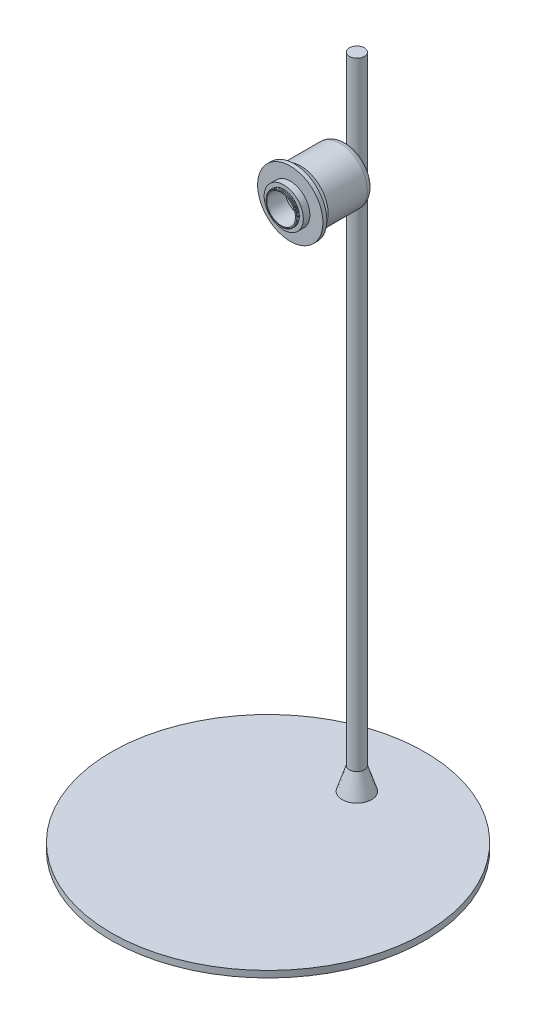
SolidWorks part; units mm, degrees
ref_plane "Alzado" through (0, 0, 0) normal (0, 0, 1) x (1, 0, 0)
ref_plane "Planta" through (0, 0, 0) normal (0, 1, 0) x (1, 0, 0)
ref_plane "Vista lateral" through (0, 0, 0) normal (1, 0, 0) x (0, 0, -1)
sketch "Croquis1" plane through (0, 0, 0) normal (0, 1, 0) x (1, 0, 0)
  circle A0 centre (0, 0) radius 120
extrude "Saliente-Extruir1" add sketch "Croquis1" along normal blind 5
sketch "Croquis2" plane through (0, 5, 0) normal (0, 1, 0) x (1, 0, 0)
  line L0 (0, 120) -> (0, 68)
  circle A0 centre (0, 0) radius 120 construction
  circle A1 centre (0, 68) radius 11.25
  dimension "D1" = 22.5
extrude "Saliente-Extruir2" add sketch "Croquis2" along normal blind 17 draft 18
sketch "Croquis3" plane through (0, 22, 0) normal (0, 1, 0) x (1, 0, 0)
  circle A0 centre (0, 68) radius 5.7264
extrude "Saliente-Extruir3" add sketch "Croquis3" along normal blind 473
ref_plane "Plano1" through (0, 0, -68) normal (0, 0, 1) x (1, 0, 0)
sketch "Croquis4" plane through (0, 0, -68) normal (0, 0, 1) x (1, 0, 0)
  line L0 (0, 495) -> (0, 420)
  line L1 (5.7264, 495) -> (-5.7264, 495) construction
  circle A0 centre (0, 420) radius 5
extrude "Saliente-Extruir4" add sketch "Croquis4" along normal blind 8
sketch "Croquis5" plane through (0, 0, -60) normal (0, 0, 1) x (1, 0, 0)
  circle A0 centre (0, 420) radius 21
extrude "Saliente-Extruir5" add sketch "Croquis5" along normal blind 35 separate body
fillet "Redondeo1" radius 5 1 edges at (21, 420, -60)
sketch "Croquis6" plane through (0, 0, -25) normal (0, 0, 1) x (1, 0, 0)
  circle A0 centre (0, 420) radius 12
extrude "Saliente-Extruir6" add sketch "Croquis6" along normal blind 15 separate body
ref_plane "Plano2" through (0, 0, -20) normal (0, 0, 1) x (1, 0, 0)
sketch "Croquis7" plane through (0, 0, -20) normal (0, 0, 1) x (1, 0, 0)
  circle A1 centre (0, 420) radius 25
  circle A2 centre (0, 420) radius 12
  dimension "D1" = 24
extrude "Saliente-Extruir7" add sketch "Croquis7" along normal blind 3 separate body
sketch "Croquis8" plane through (0, 0, -17) normal (0, 0, 1) x (1, 0, 0)
  circle A0 centre (0, 420) radius 12
  circle A1 centre (0, 420) radius 15
extrude "Saliente-Extruir8" add sketch "Croquis8" along normal blind 5
shell "Vaciado8" thickness 1
thread "Rosca1" pitch 1 start angle 0, offset 0, length 0, pitch 1, diameter 24
ref_plane "Plano3" through (12, 420, -25) normal (0, -1, 0) x (1, 0, 0)
sketch "Perfil de rosca1" plane through (12, 420, -25) normal (0, -1, 0) x (1, 0, 0)
  line L0 (0, 0) -> (0, 1) construction
  line L11 (0, 0) -> (0, 0.875)
  line L12 (0, 0.875) -> (-0.5413, 0.5625)
  line L13 (-0.5413, 0.5625) -> (-0.5413, 0.3125)
  line L15 (-0.5413, 0.3125) -> (0, 0)
  line L17 (-0.5413, 0.4375) -> (0, 0.4375) construction
  point P2 (0, 0)
  dimension "Pitch" = 1
  dimension "Profile_Angle" = 60
  dimension "Profile_Land" = 0.25
  dimension "Profile_Height" = 0.5413
thread "Rosca2" pitch 1 start angle 0, offset 0, length 0, pitch 1, diameter 24
ref_plane "Plano5" through (-12, 420, -12) normal (0, -1, 0) x (-1, 0, 0)
sketch "Perfil de rosca3" plane through (-12, 420, -12) normal (0, -1, 0) x (-1, 0, 0)
  line L0 (0, 0) -> (0, 1) construction
  line L11 (0, 0) -> (0, 0.875)
  line L12 (0, 0.875) -> (-0.5413, 0.5625)
  line L13 (-0.5413, 0.5625) -> (-0.5413, 0.3125)
  line L15 (-0.5413, 0.3125) -> (0, 0)
  line L17 (-0.5413, 0.4375) -> (0, 0.4375) construction
  point P2 (0, 0)
  dimension "Pitch" = 1
  dimension "Profile_Angle" = 60
  dimension "Profile_Land" = 0.25
  dimension "Profile_Height" = 0.5413
